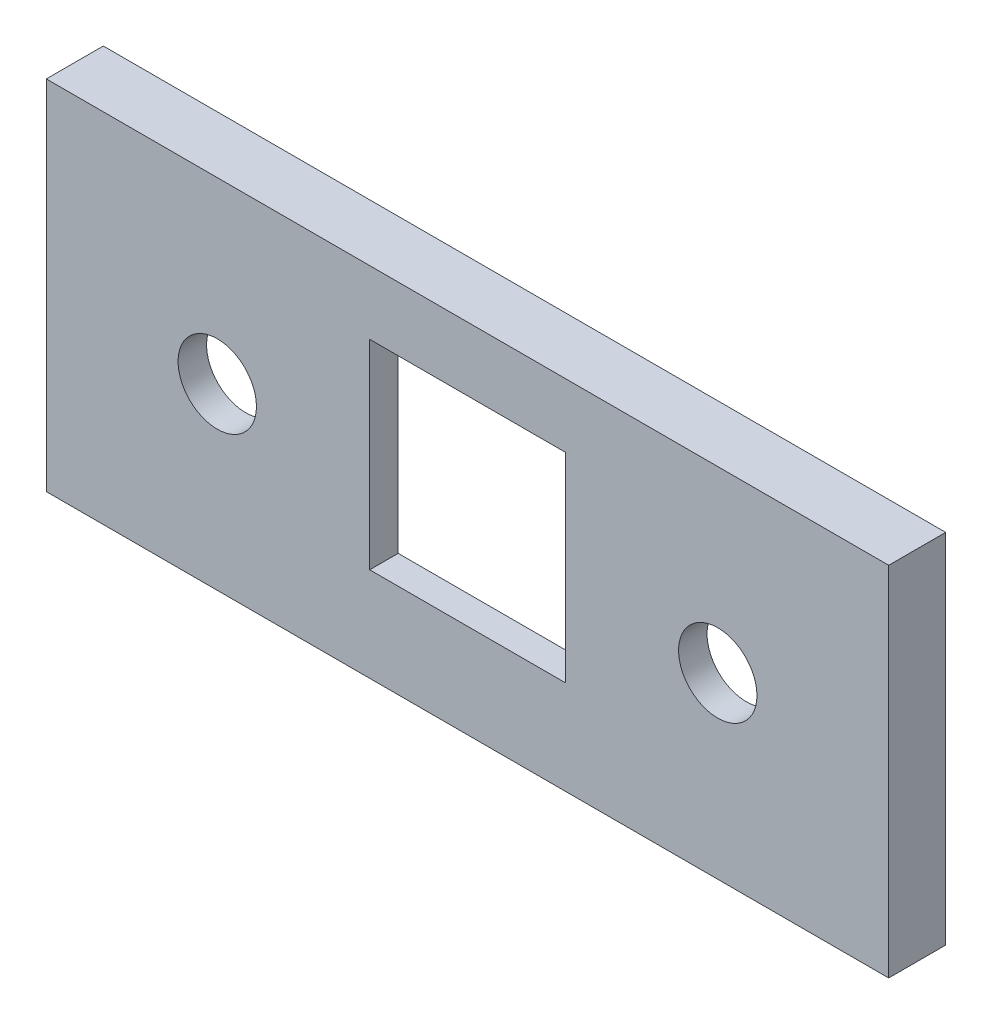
SolidWorks part; units mm, degrees
ref_plane "Plan de face" through (0, 0, 0) normal (0, 0, 1) x (1, 0, 0)
ref_plane "Plan de dessus" through (0, 0, 0) normal (0, 1, 0) x (1, 0, 0)
ref_plane "Plan de droite" through (0, 0, 0) normal (1, 0, 0) x (0, 0, -1)
sketch "Esquisse2" plane through (0, 0, 0) normal (0, 0, 1) x (1, 0, 0)
  line L0 (21.7005, 15.6089) -> (33.4305, 15.6089) construction
  line L1 (3.002, 0) -> (52.129, 0)
  line L2 (0, 3.002) -> (0, 18.088)
  line L3 (3.002, 21.09) -> (52.129, 21.09)
  line L4 (55.131, 3.002) -> (55.131, 18.088)
  line L9 (33.4305, 15.6089) -> (33.4305, 5.5989) construction
  line L10 (33.4305, 5.5989) -> (21.7005, 5.5989) construction
  line L11 (21.7005, 5.5989) -> (21.7005, 15.6089) construction
  line L13 (20.7005, 18.6089) -> (34.4305, 18.6089)
  line L14 (20.7005, 18.6089) -> (20.7005, 4.5989)
  line L15 (20.7005, 4.5989) -> (34.4305, 4.5989)
  line L16 (34.4305, 18.6089) -> (34.4305, 4.5989)
  arc A0 (3.002, 0) -> (0, 3.002) centre (3.002, 3.002) cw
  arc A1 (55.131, 3.002) -> (52.129, 0) centre (52.129, 3.002) cw
  arc A2 (55.131, 18.088) -> (52.129, 21.09) centre (52.129, 18.088) ccw
  arc A3 (0, 18.088) -> (3.002, 21.09) centre (3.002, 18.088) cw
  point P10 (27.5655, 15.6089)
  point P11 (27.5655, 21.09)
  point P17 (0, 0)
  point P22 (55.131, 21.09)
  point P25 (0, 21.09)
  dimension "D5" = 3.002
  dimension "D1" = 10.01
  dimension "D2" = 21.09
  dimension "D3" = 55.131
  dimension "D4" = 11.73
  dimension "D6" = 1
  dimension "D7" = 1
  dimension "D8" = 1
  dimension "D9" = 3
extrude "Boss.-Extru.1" add sketch "Esquisse2" along normal blind 2
sketch "Esquisse6" plane through (0, 0, 2) normal (0, 0, 1) x (1, 0, 0)
  line L0 (0, 10.545) -> (55.131, 10.545) construction
  line L1 (0, 18.088) -> (0, 3.002) construction
  line L2 (55.131, 3.002) -> (55.131, 18.088) construction
hole_wizard "Dégagement M51" positions "Esquisse3D1" profile "Esquisse5" hole size "M5" standard "ISO"
sketch3d "Esquisse3D1"
  line L0 (0, 10.545, 2) -> (55.131, 10.545, 2) construction
  line L1 (0, 18.088, 2) -> (0, 3.002, 2) construction
  point P0 (10, 10.545, 2)
  dimension "D1" = 10
sketch "Esquisse5" plane through (10, 10.545, 2) normal (1, 0, 0) x (0, -1, 0)
  line L0 (0, 0) -> (0, 2)
  line L1 (0, 2) -> (2.75, 2)
  line L2 (2.75, 2) -> (2.75, 0)
  line L5 (2.75, 0) -> (0, 0)
  line L11 (0, -6.35) -> (0, 107.95) construction
  dimension "Diamètre du perçage jusqu'au prochain" = 5.5
  dimension "Profondeur du perçage jusqu'au prochain" = 2
ref_plane "Plan1" through (27.5655, 0, 0) normal (-1, 0, 0) x (0, 0, 1)
mirror "Symétrie1" about plane through (27.5655, 0, 0) normal (-1, 0, 0) of "Dégagement M51"
sketch "Esquisse7" plane through (0, 0, 0) normal (0, 0, -1) x (-1, 0, 0)
  line L0 (-52.129, 21.09) -> (-3.002, 21.09) construction
  line L1 (-57.131, 23.09) -> (2, 23.09)
  line L2 (-57.131, 23.09) -> (-57.131, -2)
  line L3 (-57.131, -2) -> (2, -2)
  line L4 (2, 23.09) -> (2, -2)
  line L5 (-3.002, 0) -> (-52.129, 0) construction
  line L6 (0, 10.545) -> (-55.131, 10.545) construction
  line L7 (-55.131, 3.002) -> (-55.131, 18.088) construction
  line L9 (0, 18.088) -> (0, 3.002) construction
  line L10 (-3.002, 21.09) -> (-52.129, 21.09)
  line L11 (0, 18.088) -> (0, 3.002)
  line L12 (-3.002, 0) -> (-52.129, 0)
  line L13 (-55.131, 18.088) -> (-55.131, 3.002)
  arc A0 (0, 3.002) -> (-3.002, 0) centre (-3.002, 3.002) cw
  arc A1 (0, 18.088) -> (-3.002, 21.09) centre (-3.002, 18.088) ccw
  arc A2 (-55.131, 18.088) -> (-52.129, 21.09) centre (-52.129, 18.088) cw
  arc A3 (-52.129, 0) -> (-55.131, 3.002) centre (-52.129, 3.002) cw
  point P6 (-27.5655, 21.09)
  point P7 (-27.5655, 23.09)
  point P10 (-27.5655, 0)
  point P11 (-27.5655, -2)
  point P12 (-57.131, 10.545)
  dimension "D3" = 3.002
  dimension "D1" = 2
  dimension "D2" = 2
extrude "Boss.-Extru.3" add sketch "Esquisse7" along normal blind 2 and the other way up to surface (2 mm away)
